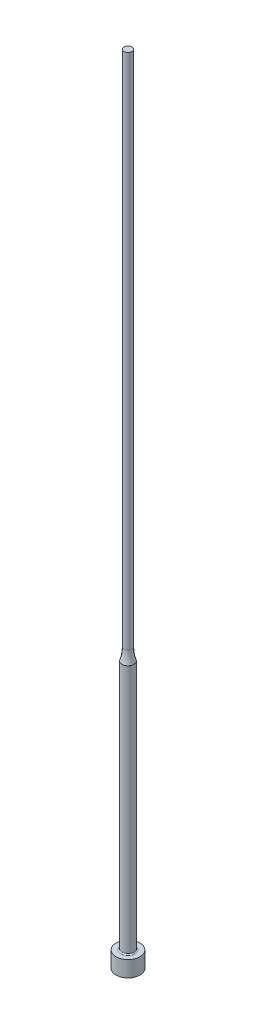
SolidWorks part; units mm, degrees
ref_plane "Front Plane" through (0, 0, 0) normal (0, 0, 1) x (1, 0, 0)
ref_plane "Top Plane" through (0, 0, 0) normal (0, 1, 0) x (1, 0, 0)
ref_plane "Right Plane" through (0, 0, 0) normal (1, 0, 0) x (0, 0, -1)
sketch "Sketch1" plane through (0, 0, 0) normal (0, 0, 1) x (1, 0, 0)
  line L0 (0, 0) -> (3, 0)
  line L1 (55, 0) -> (-55, 0) construction
  line L2 (3, 0) -> (3, 4)
  line L3 (3, 4) -> (1.8, 4)
  line L4 (1.5, 4.3) -> (1.5, 66.8775)
  line L6 (1, 70) -> (1, 200)
  line L7 (1, 200) -> (0, 200)
  line L8 (0, 200) -> (0, 0)
  arc A0 (1, 70) -> (1.5, 66.8775) centre (11, 70) ccw
  arc A1 (1.8, 4) -> (1.5, 4.3) centre (1.8, 4.3) cw
  dimension "D7" = 70
  dimension "D8" = 0.3
  dimension "D5" = 10
  dimension "D1" = 1
  dimension "D2" = 1.5
  dimension "D3" = 3
  dimension "D4" = 4
  dimension "D6" = 200
revolve "Revolve1" add sketch "Sketch1" angle 360 about L8
